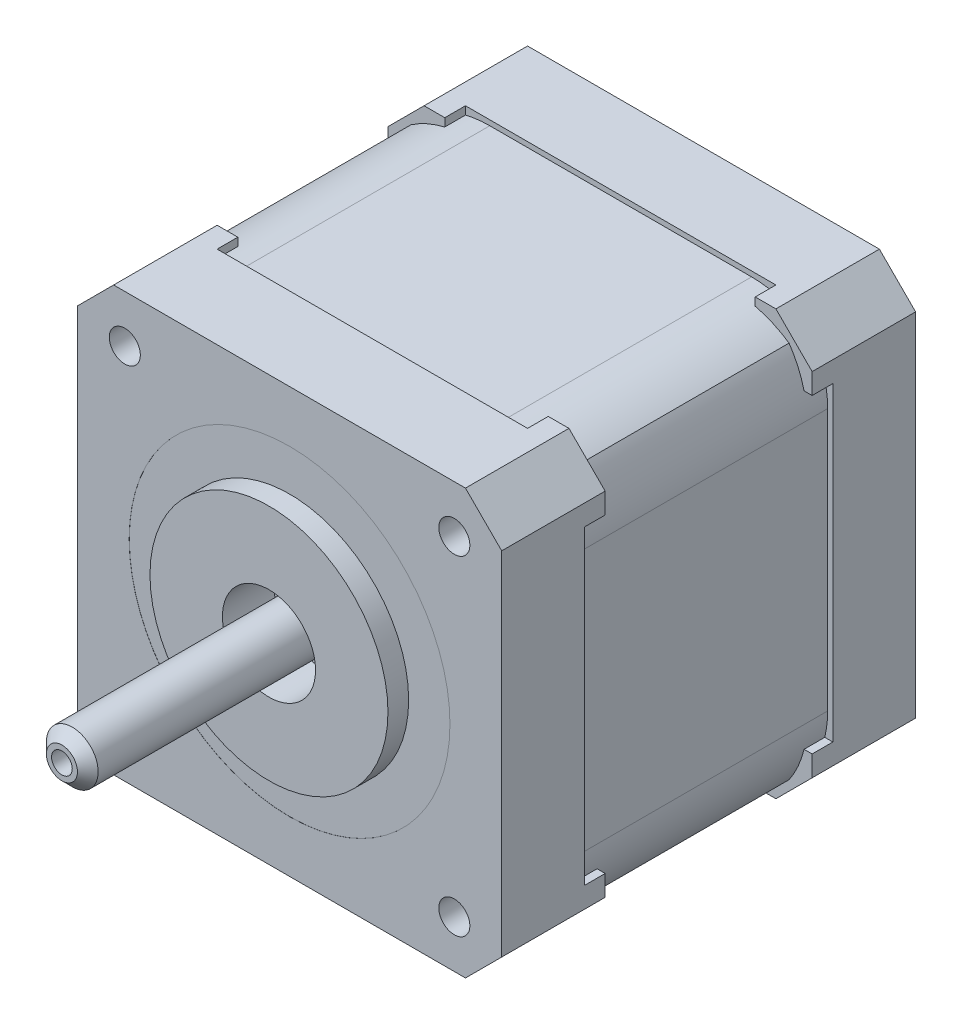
SolidWorks part; units mm, degrees
ref_plane "Ön Düzlem" through (0, 0, 0) normal (0, 0, 1) x (1, 0, 0)
ref_plane "Üst Düzlem" through (0, 0, 0) normal (0, 1, 0) x (1, 0, 0)
ref_plane "Sağ Düzlem" through (0, 0, 0) normal (1, 0, 0) x (0, 0, -1)
sketch "Çizim1" plane through (0, 0, 0) normal (0, 0, 1) x (1, 0, 0)
  line L3 (-17, 41) -> (17, 41)
  line L4 (20.5, 3.5) -> (20.5, 37.5)
  line L5 (-20.5, 3.5) -> (-20.5, 37.5)
  line L6 (17, 41) -> (20.5, 37.5)
  line L7 (-17, 41) -> (-20.5, 37.5)
  line L8 (17, 0) -> (20.5, 3.5)
  line L9 (-17, 0) -> (-20.5, 3.5)
  line L10 (-17, 0) -> (17, 0)
extrude "Yükseklik-Ekstrüzyon2" add sketch "Çizim1" along normal blind 8
sketch "Çizim5" plane through (0, 0, 0) normal (0, 0, -1) x (-1, 0, 0)
  line L0 (-20.5, 3.5) -> (-20.5, 5.5)
  line L1 (-20.5, 3.5) -> (-20.5, 37.5) construction
  line L2 (-20.5, 5.5) -> (-20, 5.5)
  line L3 (-17, 0) -> (-15, 0)
  line L4 (17, 0) -> (-17, 0) construction
  line L5 (-15, 0) -> (-15, 0.5)
  line L6 (20.5, 20.5) -> (10.3627, 20.5)
  line L7 (15, 0) -> (15, 0.5)
  line L8 (-20, 3.7071) -> (-20, 37.2929)
  line L9 (-20, 37.2929) -> (-16.7929, 40.5)
  line L10 (-16.7929, 40.5) -> (16.7929, 40.5)
  line L11 (16.7929, 40.5) -> (20, 37.2929)
  line L12 (20, 37.2929) -> (20, 3.7071)
  line L13 (20, 3.7071) -> (16.7929, 0.5)
  line L14 (16.7929, 0.5) -> (-16.7929, 0.5)
  line L15 (-16.7929, 0.5) -> (-20, 3.7071)
  line L16 (17, 0) -> (15, 0)
  line L17 (20.5, 5.5) -> (20, 5.5)
  line L18 (20.5, 3.5) -> (20.5, 5.5)
  line L19 (20.5, 37.5) -> (20.5, 3.5) construction
  line L20 (-20.5, 35.5) -> (-20, 35.5)
  line L21 (-15, 41) -> (-15, 40.5)
  line L22 (15, 41) -> (15, 40.5)
  line L23 (20.5, 37.5) -> (20.5, 35.5)
  line L24 (20.5, 35.5) -> (20, 35.5)
extrude "Yükseklik-Ekstrüzyon10" add sketch "Çizim5" along normal blind 2 contours L21 L20 L8 L9 L10 M5 M6 M7 | L24 L22 L10 L11 L12 M11 M4 M5 | L17 L12 L13 L14 L7 M11 M9 M10 | L14 L15 L8 L2 L5 M7 M8 M9
sketch "Çizim12" plane through (0, 0, 0) normal (0, 0, -1) x (-1, 0, 0)
  line L1 (-20.5, 5.5) -> (-20.5, 3.5)
  line L2 (-20.5, 3.5) -> (-17, 0)
  line L3 (-17, 0) -> (17, 0)
  line L4 (17, 0) -> (20.5, 3.5)
  line L5 (20.5, 3.5) -> (20.5, 37.5)
  line L6 (20.5, 37.5) -> (17, 41)
  line L7 (17, 41) -> (-17, 41)
  line L8 (-17, 41) -> (-20.5, 37.5)
  line L9 (-20.5, 37.5) -> (-20.5, 35.5)
  line L10 (-20.5, 35.5) -> (-20.4853, 35.5072)
  line L11 (-20, 35.5) -> (-20, 5.5)
  line L12 (-20, 5.5) -> (-20, 3.7071)
  line L13 (-20, 3.7071) -> (-16.7929, 0.5)
  line L14 (-16.7929, 0.5) -> (16.7929, 0.5)
  line L15 (16.7929, 0.5) -> (20, 3.7071)
  line L16 (20, 3.7071) -> (20, 37.2929)
  line L17 (20, 37.2929) -> (16.7929, 40.5)
  line L18 (16.7929, 40.5) -> (-16.7929, 40.5)
  line L19 (-16.7929, 40.5) -> (-20, 37.2929)
  line L20 (-20, 37.2929) -> (-20, 35.5)
  line L21 (-20.5, 35.5) -> (-20.5, 5.5) construction
  dimension "D1" = 0.5
extrude "Yükseklik-Ekstrüzyon11" add sketch "Çizim12" along normal blind 24 contours L18 L11 L14 L16 M17 M21 M22 M23 M3 M4 M5 M9 M10 M11 M15 M16
sketch "Çizim13" plane through (0, 0, -24) normal (0, 0, -1) x (-1, 0, 0)
  line L0 (-17, 41) -> (-20.5, 37.5)
  line L1 (-20.5, 37.5) -> (-20.5, 3.5)
  line L2 (-20.5, 3.5) -> (-17, 0)
  line L3 (-17, 0) -> (17, 0)
  line L4 (17, 0) -> (20.5, 3.5)
  line L5 (20.5, 3.5) -> (20.5, 37.5)
  line L6 (20.5, 37.5) -> (17, 41)
  line L7 (17, 41) -> (-17, 41)
extrude "Yükseklik-Ekstrüzyon12" add sketch "Çizim13" along normal blind 8
sketch "Çizim14" plane through (0, 0, -24) normal (0, 0, 1) x (1, 0, 0)
  line L0 (17, 41) -> (15, 41)
  line L1 (-17, 41) -> (17, 41) construction
  line L2 (15, 41) -> (15, 40.5)
  line L3 (-16.7929, 40.5) -> (16.7929, 40.5) construction
  line L4 (15, 40.5) -> (16.7929, 40.5)
  line L5 (16.7929, 40.5) -> (20, 37.2929)
  line L6 (20.5, 37.5) -> (20.5, 35.5)
  line L7 (20.5, 37.5) -> (20.5, 3.5) construction
  line L8 (20.5, 35.5) -> (20, 35.5)
  line L9 (20, 37.2929) -> (20, 3.7071) construction
  line L10 (20, 35.5) -> (20, 37.2929)
  line L11 (20.5, 37.5) -> (17, 41)
  line L12 (0, 0) -> (0, 15.5815)
  line L13 (17, 0) -> (15, 0)
  line L14 (15, 0) -> (15, 0.5)
  line L15 (15, 0.5) -> (16.7929, 0.5)
  line L16 (20.5, 3.5) -> (17, 0)
  line L17 (16.7929, 0.5) -> (20, 3.7071)
  line L18 (20, 5.5) -> (20, 3.7071)
  line L19 (20.5, 3.5) -> (20.5, 5.5)
  line L20 (20.5, 5.5) -> (20, 5.5)
  line L21 (-20.5, 5.5) -> (-20, 5.5)
  line L22 (-20.5, 3.5) -> (-20.5, 5.5)
  line L23 (-20, 5.5) -> (-20, 3.7071)
  line L24 (-20.5, 3.5) -> (-17, 0)
  line L25 (-16.7929, 0.5) -> (-20, 3.7071)
  line L26 (-15, 0.5) -> (-16.7929, 0.5)
  line L27 (-15, 0) -> (-15, 0.5)
  line L28 (-17, 0) -> (-15, 0)
  line L29 (-20.5, 35.5) -> (-20, 35.5)
  line L30 (-20, 35.5) -> (-20, 37.2929)
  line L31 (-20.5, 37.5) -> (-20.5, 35.5)
  line L32 (-20.5, 37.5) -> (-17, 41)
  line L33 (-16.7929, 40.5) -> (-20, 37.2929)
  line L34 (-15, 40.5) -> (-16.7929, 40.5)
  line L35 (-17, 41) -> (-15, 41)
  line L36 (-15, 41) -> (-15, 40.5)
extrude "Yükseklik-Ekstrüzyon14" add sketch "Çizim14" along normal blind 2 contours L36 L29 M19 M20 M21 M31 M32 M33 | L27 L21 M23 M29 M30 M31 M21 M22 | L20 L14 M25 M27 M28 M29 M23 M24 | L8 L2 M25 M26 M19 M33 M34 M27
fillet "Radyus5" radius 10 8 edges at (-20, 3.7071, -12) (-16.7929, 0.5, -12) (-16.7929, 40.5, -12) (-20, 37.2929, -12) (20, 37.2929, -12) (16.7929, 40.5, -12) (20, 3.7071, -12) (16.7929, 0.5, -12)
sketch "Çizim15" plane through (0, 0, -32) normal (0, 0, -1) x (-1, 0, 0)
  circle A0 centre (0, 20.5) radius 4.5
extrude "Kes-Ekstrüzyon3" cut sketch "Çizim15" against normal blind 3
fillet "Radyus6" radius 0.5 1 edges at (-4.5, 20.5, -32)
sketch "Çizim16" plane through (0, 0, -29) normal (0, 0, -1) x (-1, 0, 0)
  circle A0 centre (0, 20.5) radius 3
extrude "Yükseklik-Ekstrüzyon15" add sketch "Çizim16" along normal blind 1
fillet "Radyus7" radius 0.5 1 edges at (-3, 20.5, -30)
sketch "Çizim17" plane through (0, 0, -30) normal (0, 0, -1) x (-1, 0, 0)
  line L1 (1.2603, 19.7965) -> (1.2394, 21.2397)
  line L2 (1.2394, 21.2397) -> (-0.0209, 21.9432)
  line L3 (-0.0209, 21.9432) -> (-1.2603, 21.2035)
  line L4 (-1.2603, 21.2035) -> (-1.2394, 19.7603)
  line L5 (-1.2394, 19.7603) -> (0.0209, 19.0568)
  line L6 (0.0209, 19.0568) -> (1.2603, 19.7965)
  circle A0 centre (0, 20.5) radius 1.25 construction
extrude "Kes-Ekstrüzyon4" cut sketch "Çizim17" against normal blind 0.5
sketch "Çizim18" plane through (0, 0, -32) normal (0, 0, -1) x (-1, 0, 0)
  line L0 (0, 20.5) -> (0, 35.5)
  line L1 (0, 20.5) -> (15, 20.5)
  line L2 (0, 35.5) -> (15, 35.5)
  line L3 (15, 35.5) -> (15, 20.5)
  circle A0 centre (15, 35.5) radius 3
  circle A1 centre (15, 5.5) radius 3
  circle A2 centre (-15, 5.5) radius 3
  circle A3 centre (-15, 35.5) radius 3
extrude "Kes-Ekstrüzyon5" cut sketch "Çizim18" against normal blind 1 contours A2 | A0 | A1 | A3
sketch "Çizim19" plane through (0, 0, -31) normal (0, 0, -1) x (-1, 0, 0)
  circle A0 centre (15, 35.5) radius 2
  circle A1 centre (15, 5.5) radius 2
  circle A2 centre (-15, 5.5) radius 2
  circle A3 centre (-15, 35.5) radius 2
extrude "Yükseklik-Ekstrüzyon17" add sketch "Çizim19" along normal blind 0.5
fillet "Radyus8" radius 0.5 4 edges at (13, 5.5, -31.5) (-13, 5.5, -31.5) (-17, 35.5, -31.5) (17, 35.5, -31.5)
sketch "Çizim21" plane through (0, 0, -31.5) normal (0, 0, -1) x (-1, 0, 0)
  line L0 (0, 20.5) -> (9.2525, 20.5)
  line L1 (9.2525, 20.5) -> (0, 20.5)
  line L2 (0, 20.5) -> (0, 30.2455)
  line L3 (15.15, 6.5) -> (14.85, 6.5)
  line L4 (15.15, 35.65) -> (15.15, 36.5)
  line L5 (15.15, 35.35) -> (16, 35.35)
  line L6 (14.85, 35.35) -> (14.85, 34.5)
  line L7 (14.85, 35.65) -> (14, 35.65)
  line L8 (14.85, 35.65) -> (14.85, 36.5)
  line L9 (15.15, 35.65) -> (16, 35.65)
  line L10 (15.15, 35.35) -> (15.15, 34.5)
  line L11 (14.85, 35.35) -> (14, 35.35)
  line L12 (14.85, 36.5) -> (15.15, 36.5)
  line L13 (16, 35.65) -> (16, 35.35)
  line L14 (15.15, 34.5) -> (14.85, 34.5)
  line L15 (14, 35.35) -> (14, 35.65)
  line L16 (14, 35.65) -> (14.0342, 35.6422)
  line L17 (14, 5.35) -> (14.0342, 5.3578)
  line L18 (14, 5.65) -> (14, 5.35)
  line L19 (16, 5.35) -> (16, 5.65)
  line L20 (14.85, 5.65) -> (14, 5.65)
  line L21 (15.15, 5.65) -> (15.15, 6.5)
  line L22 (15.15, 5.35) -> (16, 5.35)
  line L23 (14.85, 5.35) -> (14, 5.35)
  line L24 (14.85, 5.65) -> (14.85, 6.5)
  line L25 (15.15, 5.65) -> (16, 5.65)
  line L26 (14.85, 4.5) -> (15.15, 4.5)
  line L27 (14.85, 5.35) -> (14.85, 4.5)
  line L28 (15.15, 5.35) -> (15.15, 4.5)
  line L29 (-14, 35.65) -> (-14.0342, 35.6422)
  line L30 (-14, 35.35) -> (-14, 35.65)
  line L31 (-14.85, 36.5) -> (-15.15, 36.5)
  line L32 (-15.15, 34.5) -> (-14.85, 34.5)
  line L33 (-16, 35.65) -> (-16, 35.35)
  line L34 (-14.85, 35.35) -> (-14, 35.35)
  line L35 (-15.15, 35.35) -> (-15.15, 34.5)
  line L36 (-15.15, 35.65) -> (-16, 35.65)
  line L37 (-14.85, 35.65) -> (-14.85, 36.5)
  line L38 (-14.85, 35.65) -> (-14, 35.65)
  line L39 (-14.85, 35.35) -> (-14.85, 34.5)
  line L40 (-15.15, 35.35) -> (-16, 35.35)
  line L41 (-15.15, 35.65) -> (-15.15, 36.5)
  line L42 (-16, 5.35) -> (-16, 5.65)
  line L43 (-15.15, 5.35) -> (-15.15, 4.5)
  line L44 (-14.85, 5.35) -> (-14.85, 4.5)
  line L45 (-14.85, 4.5) -> (-15.15, 4.5)
  line L46 (-15.15, 5.65) -> (-16, 5.65)
  line L47 (-14.85, 5.65) -> (-14.85, 6.5)
  line L48 (-14.85, 5.35) -> (-14, 5.35)
  line L49 (-15.15, 5.35) -> (-16, 5.35)
  line L50 (-15.15, 5.65) -> (-15.15, 6.5)
  line L51 (-14.85, 5.65) -> (-14, 5.65)
  line L52 (-14, 5.65) -> (-14, 5.35)
  line L53 (-14, 5.35) -> (-14.0342, 5.3578)
  line L54 (-15.15, 6.5) -> (-14.85, 6.5)
  point P0 (15, 35.5)
  point P1 (15, 36.5)
  point P3 (15.15, 35.5)
  point P4 (16, 35.5)
  point P5 (15, 34.5)
  point P10 (14.85, 35.5)
  point P14 (14.85, 35.5)
extrude "Kes-Ekstrüzyon6" cut sketch "Çizim21" against normal blind 0.1
sketch "Çizim22" plane through (0, 0, 8) normal (0, 0, 1) x (1, 0, 0)
  circle A0 centre (0, 20.5) radius 4.5
extrude "Kes-Ekstrüzyon7" cut sketch "Çizim22" against normal blind 3
sketch "Çizim23" plane through (0, 0, 5) normal (0, 0, 1) x (1, 0, 0)
  circle A0 centre (0, 20.5) radius 2.5
extrude "Yükseklik-Ekstrüzyon18" add sketch "Çizim23" along normal blind 25
sketch "Çizim24" plane through (0, 0, 30) normal (0, 0, 1) x (1, 0, 0)
  circle A0 centre (0, 20.5) radius 1
extrude "Kes-Ekstrüzyon8" cut sketch "Çizim24" against normal blind 2
chamfer "Pah1" distance 1 angle 45 1 edges at (2.5, 20.5, 30)
sketch "Çizim25" plane through (0, 0, 8) normal (0, 0, 1) x (1, 0, 0)
  line L0 (20.5, 20.5) -> (15.5, 20.5)
  line L1 (20.5, 3.5) -> (20.5, 37.5) construction
  circle A0 centre (0, 20.5) radius 4.5
  circle A1 centre (0, 20.5) radius 15.5
extrude "Kes-Ekstrüzyon9" cut sketch "Çizim25" against normal blind 0.01 contours A1 M2
sketch "Çizim26" plane through (0, 0, 7.99) normal (0, 0, 1) x (1, 0, 0)
  line L0 (15.5, 20.5) -> (11.5, 20.5)
  circle A0 centre (0, 20.5) radius 4.5
  circle A1 centre (0, 20.5) radius 15.5 construction
  circle A2 centre (0, 20.5) radius 11.5
extrude "Yükseklik-Ekstrüzyon19" add sketch "Çizim26" along normal blind 2 contours A2 M2
sketch "Çizim28" plane through (0, 0, 8) normal (0, 0, 1) x (1, 0, 0)
  line L2 (0, 20.5) -> (0, 27.7903)
  line L3 (0, 27.7903) -> (0, 20.5)
  line L4 (0, 20.5) -> (6.5303, 20.5)
  circle A0 centre (-15.9216, 36.4216) radius 1.5
  circle A1 centre (15.9216, 36.4216) radius 1.5
  circle A2 centre (-15.9216, 4.5784) radius 1.5
  circle A3 centre (15.9216, 4.5784) radius 1.5
extrude "Kes-Ekstrüzyon10" cut sketch "Çizim28" against normal blind 6 contours A1 | A0 | A3 | A2
